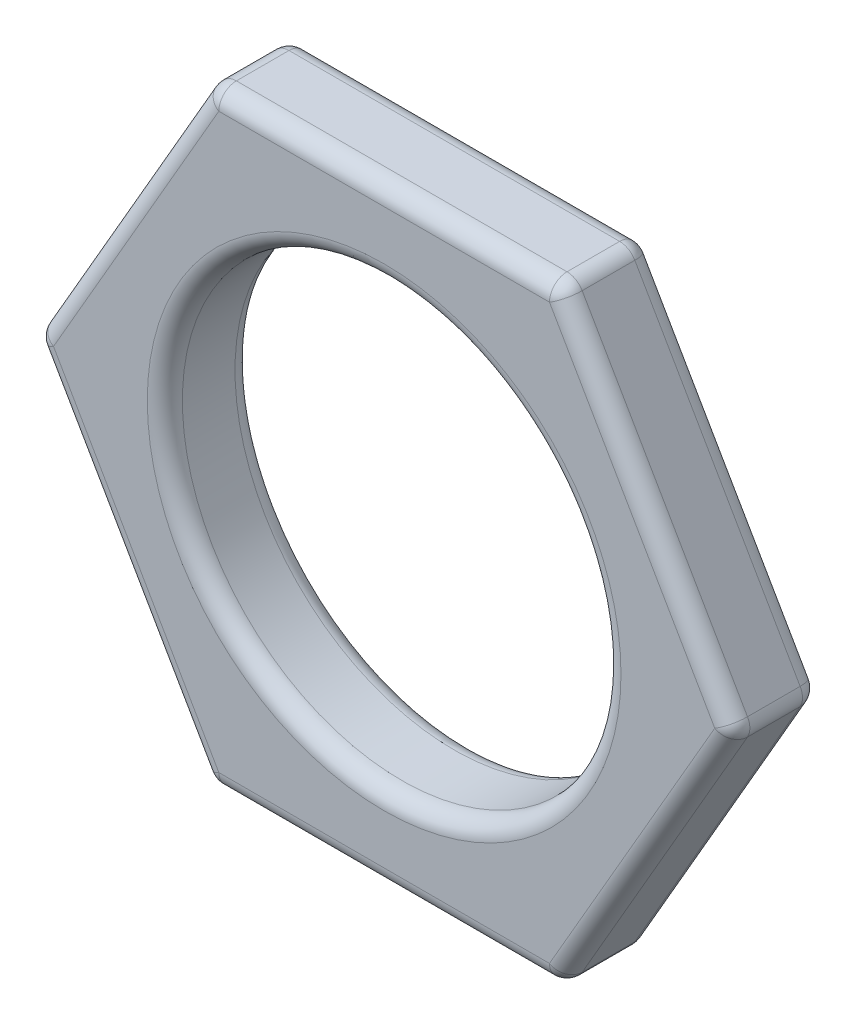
SolidWorks part; units mm, degrees
ref_plane "Front" through (0, 0, 0) normal (0, 0, 1) x (1, 0, 0)
ref_plane "Top" through (0, 0, 0) normal (0, 1, 0) x (1, 0, 0)
ref_plane "Right" through (0, 0, 0) normal (1, 0, 0) x (0, 0, -1)
sketch "Sketch1" plane through (0, 0, 0) normal (0, 0, 1) x (1, 0, 0)
  line L1 (6.35, 0) -> (3.175, 5.4993)
  line L2 (3.175, 5.4993) -> (-3.175, 5.4993)
  line L3 (-3.175, 5.4993) -> (-6.35, 0)
  line L4 (-6.35, 0) -> (-3.175, -5.4993)
  line L5 (-3.175, -5.4993) -> (3.175, -5.4993)
  line L6 (3.175, -5.4993) -> (6.35, 0)
  circle A0 centre (0, 0) radius 5.4993 construction
  circle A1 centre (0, 0) radius 3.9688
  dimension "D2" = 7.9375
  dimension "D1" = 6.35
extrude "Extrude1" add sketch "Sketch1" along normal blind 1.5875
fillet "Fillet4" radius 0.3175 20 edges at (3.9688, 0, 0) (4.7625, 2.7496, 0) (0, 5.4993, 0) (-4.7625, 2.7496, 0) (-4.7625, -2.7496, 0) (0, -5.4993, 0) (4.7625, -2.7496, 0) (3.9688, 0, 1.5875) (0, -5.4993, 1.5875) (-4.7625, -2.7496, 1.5875) (-4.7625, 2.7496, 1.5875) (0, 5.4993, 1.5875) (4.7625, 2.7496, 1.5875) (4.7625, -2.7496, 1.5875) (3.175, -5.4993, 0.7937) (6.35, 0, 0.7937) (3.175, 5.4993, 0.7937) (-3.175, -5.4993, 0.7937) (-3.175, 5.4993, 0.7937) (-6.35, 0, 0.7937)
